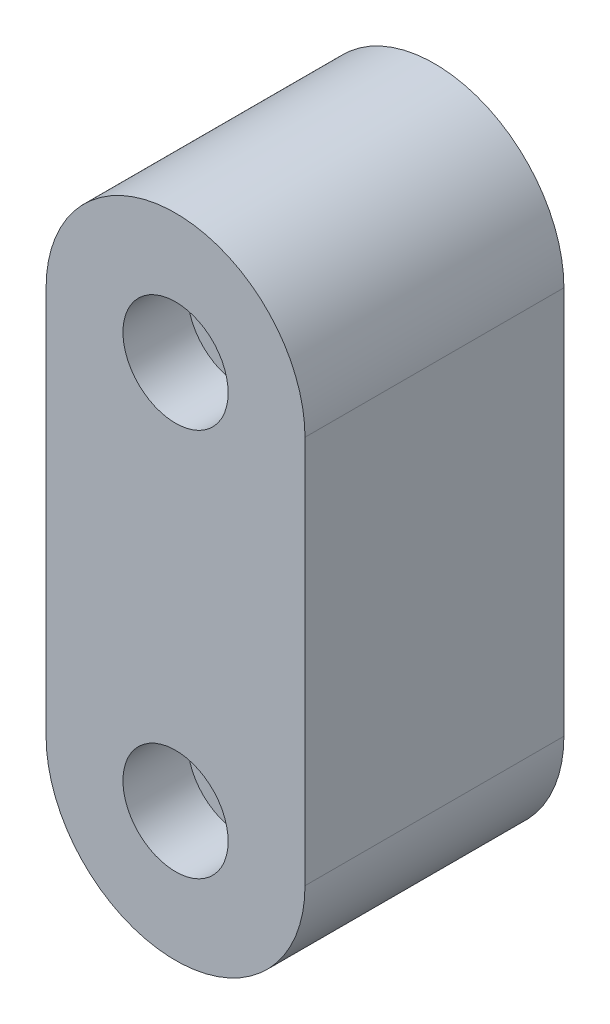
SolidWorks part; units mm, degrees
ref_plane "Płaszczyzna przednia" through (0, 0, 0) normal (0, 0, 1) x (1, 0, 0)
ref_plane "Płaszczyzna górna" through (0, 0, 0) normal (0, 1, 0) x (1, 0, 0)
ref_plane "Płaszczyzna prawa" through (0, 0, 0) normal (1, 0, 0) x (0, 0, -1)
sketch "Szkic1" plane through (0, 0, 0) normal (0, 0, 1) x (1, 0, 0)
  line L0 (0, 16) -> (0, -8) construction
  line L1 (8, 16) -> (8, -8)
  line L2 (-8, 16) -> (-8, -8)
  arc A0 (8, 16) -> (-8, 16) centre (0, 16) ccw
  arc A1 (-8, -8) -> (8, -8) centre (0, -8) ccw
  point P3 (0, 4)
  dimension "D2" = 24
  dimension "D3" = 16
  dimension "D1" = 16
extrude "Dodanie-wyciągnięcie1" add sketch "Szkic1" along normal blind 16
hole_wizard "Pogłębienie walcowe pod M3 Wkręt z łbem walcowym1" positions "Szkic2" profile "Szkic3" counterbore size "M3" standard "ISO"
sketch "Szkic2" plane through (0, -40.1011, 16) normal (0, 0, 1) x (0, 1, 0)
  point P0 (56.1011, 0)
  point P1 (32.1011, 0)
sketch "Szkic3" plane through (0, 16, 16) normal (1, 0, 0) x (0, -1, 0)
  line L0 (0, 0) -> (0, 16)
  line L1 (0, 16) -> (1.7, 16)
  line L3 (1.7, 16) -> (1.7, 4)
  line L4 (1.7, 4) -> (3.25, 4)
  line L5 (3.25, 4) -> (3.25, 0)
  line L7 (3.25, 0) -> (0, 0)
  line L11 (0, -6.35) -> (0, 107.95) construction
  dimension "Średnica otworu na wylot" = 3.4
  dimension "Głębokość otworu na wylot" = 16
  dimension "Średnica pogłębienia walcowego" = 6.5
  dimension "Głębokość pogłębienia walcowego" = 4
